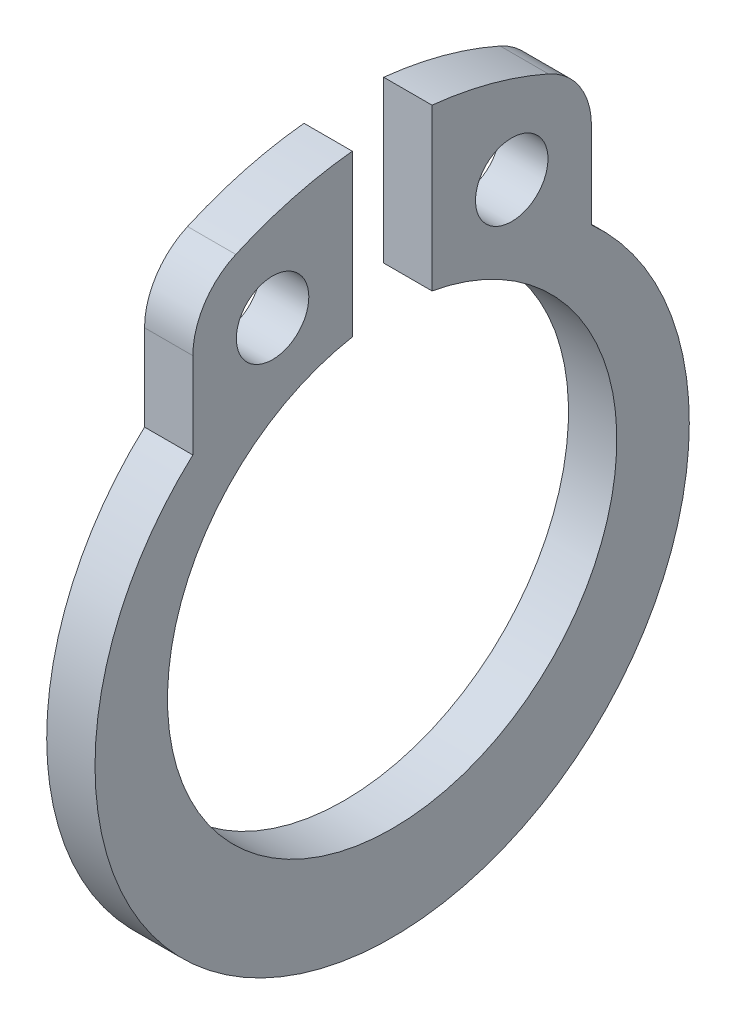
SolidWorks part; units mm, degrees
ref_plane "Plan de face" through (0, 0, 0) normal (0, 0, 1) x (1, 0, 0)
ref_plane "Plan de dessus" through (0, 0, 0) normal (0, 1, 0) x (1, 0, 0)
ref_plane "Plan de droite" through (0, 0, 0) normal (1, 0, 0) x (0, 0, -1)
ref_plane "Plan1" through (0, 0, 0) normal (-1, 0, 0) x (0, -1, 0)
sketch "Esquisse1" plane through (0, 0, 0) normal (-1, 0, 0) x (0, -1, 0)
  line L0 (-7.9071, 0.825) -> (-4.5762, 0.825)
  line L1 (-4.5762, -0.825) -> (-7.9071, -0.825)
  line L2 (-5.8917, -4.125) -> (-4.1115, -4.125)
  line L3 (-4.1115, 4.125) -> (-5.8917, 4.125)
  arc A0 (-5.8917, 4.125) -> (-7.2618, 3.2355) centre (-5.8917, 2.625) ccw
  arc A1 (-7.2618, 3.2355) -> (-7.9071, 0.825) centre (0, 0) ccw
  arc A2 (-4.5762, 0.825) -> (-4.5762, -0.825) centre (0, 0) cw
  arc A3 (-7.9071, -0.825) -> (-7.2618, -3.2355) centre (0, 0) ccw
  arc A4 (-7.2618, -3.2355) -> (-5.8917, -4.125) centre (-5.8917, -2.625) ccw
  arc A5 (-4.1115, -4.125) -> (-4.1115, 4.125) centre (0.45, 0) ccw
  circle A6 centre (-5.7458, -2.475) radius 0.75
  circle A7 centre (-5.7458, 2.475) radius 0.75
  dimension "D1" = 4.65
extrude "Boss.-Extru.1" add sketch "Esquisse1" against normal blind 1
other "Bloquer***"
